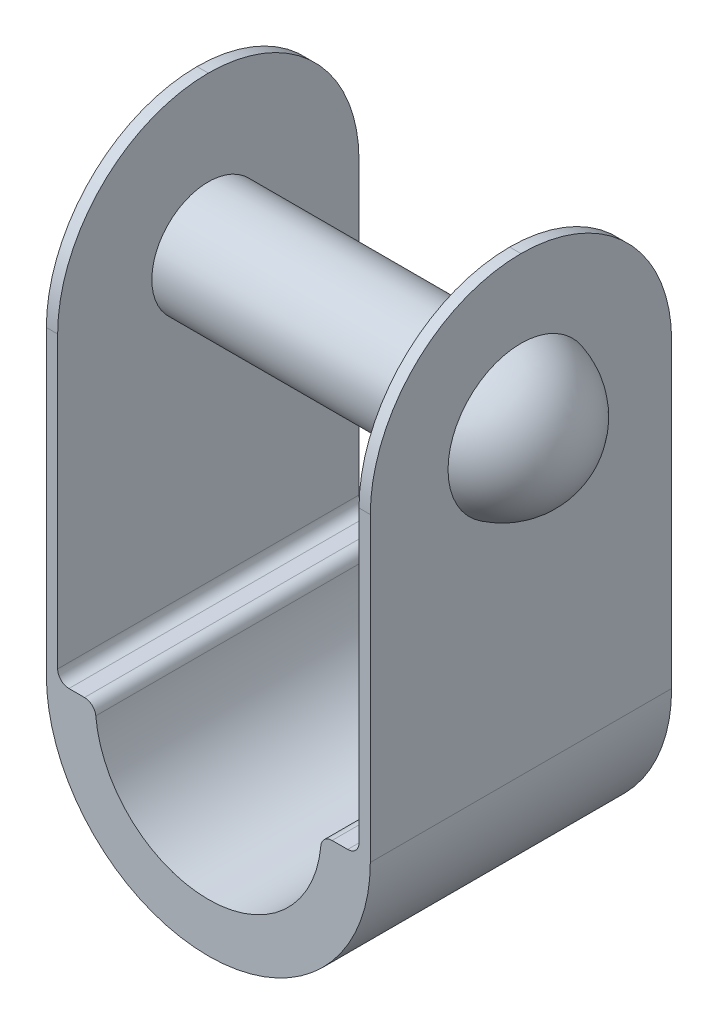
SolidWorks part; units mm, degrees
ref_plane "Plan de face" through (0, 0, 0) normal (0, 0, 1) x (1, 0, 0)
ref_plane "Plan de dessus" through (0, 0, 0) normal (0, 1, 0) x (1, 0, 0)
ref_plane "Plan de droite" through (0, 0, 0) normal (1, 0, 0) x (0, 0, -1)
sketch "Esquisse1" plane through (0, 0, 0) normal (0, 0, 1) x (1, 0, 0)
  line L0 (-40, 120) -> (-40, 0)
  line L1 (40, 120) -> (40, 0)
  line L2 (-43, 0) -> (-43, 120)
  line L3 (-43, 120) -> (-40, 120)
  line L4 (43, 0) -> (43, 120)
  line L5 (40, 120) -> (43, 120)
  arc A0 (-40, 0) -> (40, 0) centre (0, 0) ccw
  arc A1 (-43, 0) -> (43, 0) centre (0, 0) ccw
  dimension "D1" = 80
  dimension "D2" = 3
  dimension "D3" = 120
extrude "Boss.-Extru.1" add sketch "Esquisse1" along normal mid plane 80
fillet "Congé1" radius 40 4 edges at (-41.5, 120, -40) (41.5, 120, -40) (41.5, 120, 40) (-41.5, 120, 40)
sketch "Esquisse2" plane through (0, 0, 0) normal (1, 0, 0) x (0, 0, -1)
  circle A0 centre (0, 80) radius 15
  arc A1 (40, 80) -> (0, 120) centre (0, 80) ccw construction
  dimension "D1" = 30
extrude "Enlèv. mat.-Extru.1" cut sketch "Esquisse2" against normal through all and the other way through all
sketch "Esquisse3" plane through (0, 0, 40) normal (0, 0, 1) x (1, 0, 0)
  line L6 (-30, 0) -> (-40, 0)
  line L7 (30, 0) -> (40, 0)
  arc A3 (-40, 0) -> (40, 0) centre (0, 0) ccw construction
  arc A4 (-30, 0) -> (30, 0) centre (0, 0) ccw
  arc A5 (-30, 0) -> (30, 0) centre (0, 0) ccw
  arc A6 (-40, 0) -> (40, 0) centre (0, 0) ccw
  dimension "D1" = 10
extrude "Boss.-Extru.2" add sketch "Esquisse3" against normal up to surface (80 mm away)
fillet "Congé2" radius 3 4 edges at (-40, 0, 0) (-30, 0, 0) (40, 0, 0) (30, 0, 0)
sketch "Esquisse4" plane through (0, 0, 0) normal (0, 0, 1) x (1, 0, 0)
  line L0 (-79.943, 80) -> (83.1461, 80) construction
  line L1 (-43, 95) -> (43, 95)
  line L2 (43, 95) -> (43, 99.3649)
  line L3 (43, 80) -> (43, 120) construction
  line L4 (58, 80) -> (-58, 80)
  line L5 (-43, 120) -> (-43, 80) construction
  line L6 (-43, 99.3649) -> (-43, 95)
  line L7 (0, 95) -> (0, 74.8496) construction
  arc A0 (43, 99.3649) -> (58, 80) centre (38, 80) cw
  arc A1 (-58, 80) -> (-43, 99.3649) centre (-38, 80) cw
  dimension "D1" = 20
  dimension "D2" = 5
revolve "Révolution1" add sketch "Esquisse4" angle 360 about L0
equation "\"D1@Congé1\" = \"D1@Boss.-Extru.1\"/2"
